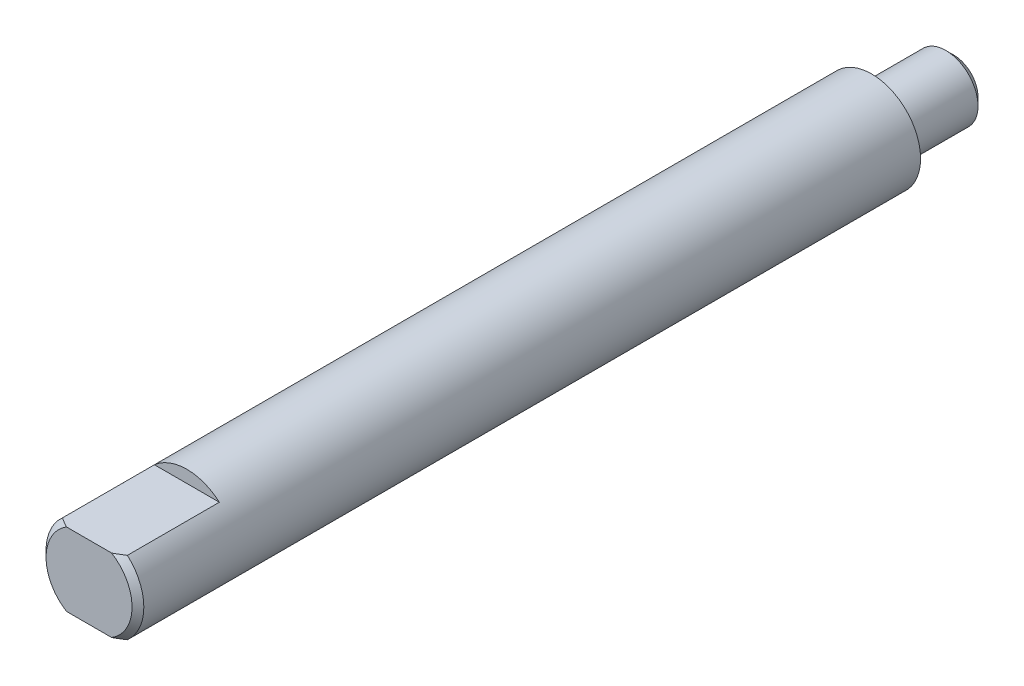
SolidWorks part; units mm, degrees
ref_plane "Front" through (0, 0, 0) normal (0, 0, 1) x (1, 0, 0)
ref_plane "Top" through (0, 0, 0) normal (0, 1, 0) x (1, 0, 0)
ref_plane "Right" through (0, 0, 0) normal (1, 0, 0) x (0, 0, -1)
sketch "Sketch1" plane through (0, 0, 0) normal (1, 0, 0) x (0, 0, -1)
  line L0 (52.066, 1.5728) -> (51.556, 2.0828)
  line L1 (-4.064, 0) -> (52.066, 0)
  line L2 (-4.064, 0) -> (-4.064, 2.79)
  line L3 (-3.684, 3.175) -> (46.736, 3.175)
  line L4 (46.736, 2.0828) -> (46.736, 3.175)
  line L5 (153.7168, 0) -> (50153.7168, 0) construction
  line L6 (-4.064, 2.79) -> (-3.684, 3.175)
  line L7 (46.736, 2.0828) -> (51.556, 2.0828)
  line L8 (52.066, 0) -> (52.066, 1.5728)
  point P2 (0, 0)
  point P12 (-4.4312, 5.773)
  dimension "D1" = 50.8
  dimension "D2" = 5.33
  dimension "D3" = 6.35
  dimension "D4" = 4.1656
  dimension "D5" = 45
  dimension "D6" = 0.51
  dimension "D7" = 2.79
  dimension "D8" = 0.38
  dimension "D9" = 4.064
revolve "Revolve1" add sketch "Sketch1" angle 360 about L1
sketch "Sketch2" plane through (0, 0, 0) normal (1, 0, 0) x (0, 0, -1)
  line L0 (-4.064, 2.79) -> (-4.064, -2.79) construction
  line L1 (-4.064, 2.375) -> (2.286, 2.375)
  line L2 (-4.064, 2.375) -> (-4.064, 3.175)
  line L3 (-4.064, 3.175) -> (2.286, 3.175)
  line L4 (2.286, 2.375) -> (2.286, 3.175)
  line L5 (46.736, 3.175) -> (-3.684, 3.175) construction
  line L6 (-4.064, 0) -> (6.0404, 0) construction
  line L7 (2.286, -2.375) -> (2.286, -3.175)
  line L8 (-4.064, -3.175) -> (2.286, -3.175)
  line L9 (-4.064, -2.375) -> (-4.064, -3.175)
  line L10 (-4.064, -2.375) -> (2.286, -2.375)
  dimension "D1" = 0.8
  dimension "D2" = 6.35
extrude "Cut-Extrude1" cut sketch "Sketch2" against normal mid plane 10
